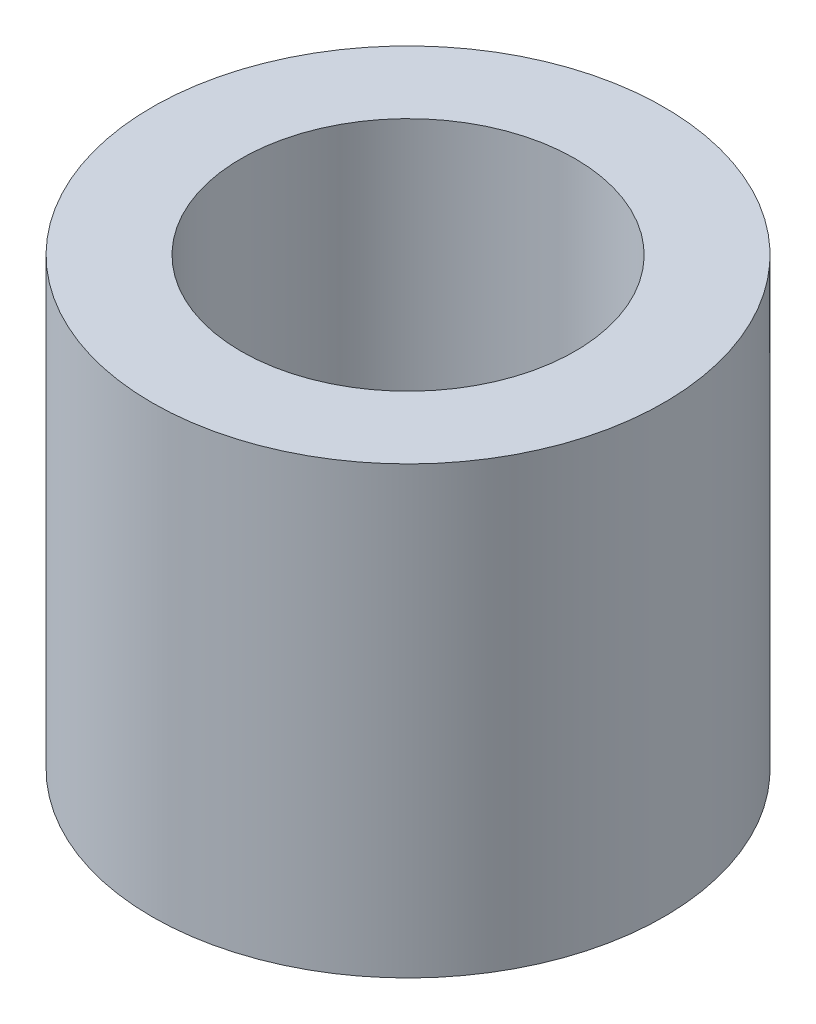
SolidWorks part; units mm, degrees
ref_plane "前视基准面" through (0, 0, 0) normal (0, 0, 1) x (1, 0, 0)
ref_plane "上视基准面" through (0, 0, 0) normal (0, 1, 0) x (1, 0, 0)
ref_plane "右视基准面" through (0, 0, 0) normal (1, 0, 0) x (0, 0, -1)
sketch "Sketch1" plane through (0, 0, 0) normal (0, 1, 0) x (1, 0, 0)
  circle A0 centre (0, 0) radius 2.3
  circle A1 centre (0, 0) radius 1.5
  dimension "D1" = 4.6
  dimension "D2" = 3
extrude "Boss-Extrude1" add sketch "Sketch1" along normal blind 4
